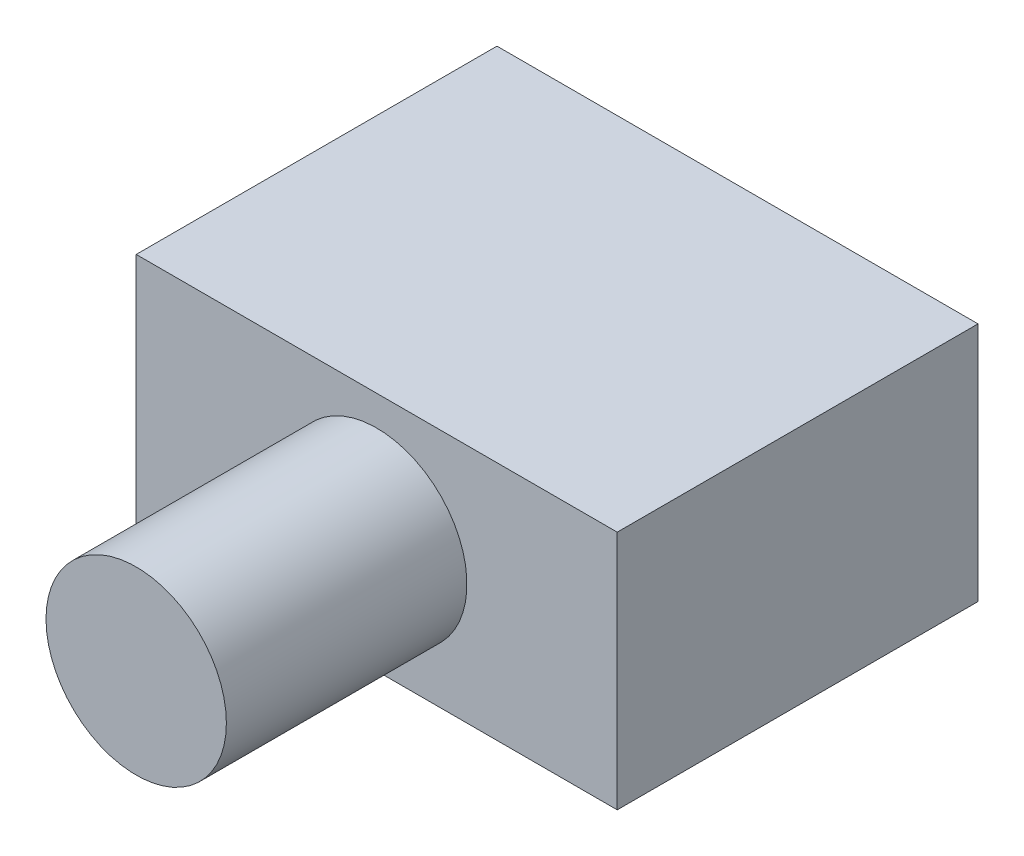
SolidWorks part; units mm, degrees
ref_plane "Front" through (0, 0, 0) normal (0, 0, 1) x (1, 0, 0)
ref_plane "Top" through (0, 0, 0) normal (0, 1, 0) x (1, 0, 0)
ref_plane "Right" through (0, 0, 0) normal (1, 0, 0) x (0, 0, -1)
sketch "Sketch1" plane through (0, 0, 0) normal (0, 0, 1) x (1, 0, 0)
  circle A0 centre (0, 0) radius 9.525
  dimension "D1" = 19.05
extrude "Base-Extrude" add sketch "Sketch1" along normal mid plane 25.4
sketch "Sketch2" plane through (0, 0, -12.7) normal (0, 0, -1) x (-1, 0, 0)
  line L0 (25.4, -12.7) -> (-25.4, 12.7) construction
  line L1 (25.4, -12.7) -> (-25.4, -12.7)
  line L2 (25.4, -12.7) -> (25.4, 12.7)
  line L3 (25.4, 12.7) -> (-25.4, 12.7)
  line L4 (-25.4, -12.7) -> (-25.4, 12.7)
  dimension "D1" = 50.8
  dimension "D2" = 25.4
extrude "Boss-Extrude1" add sketch "Sketch2" along normal blind 38.1
